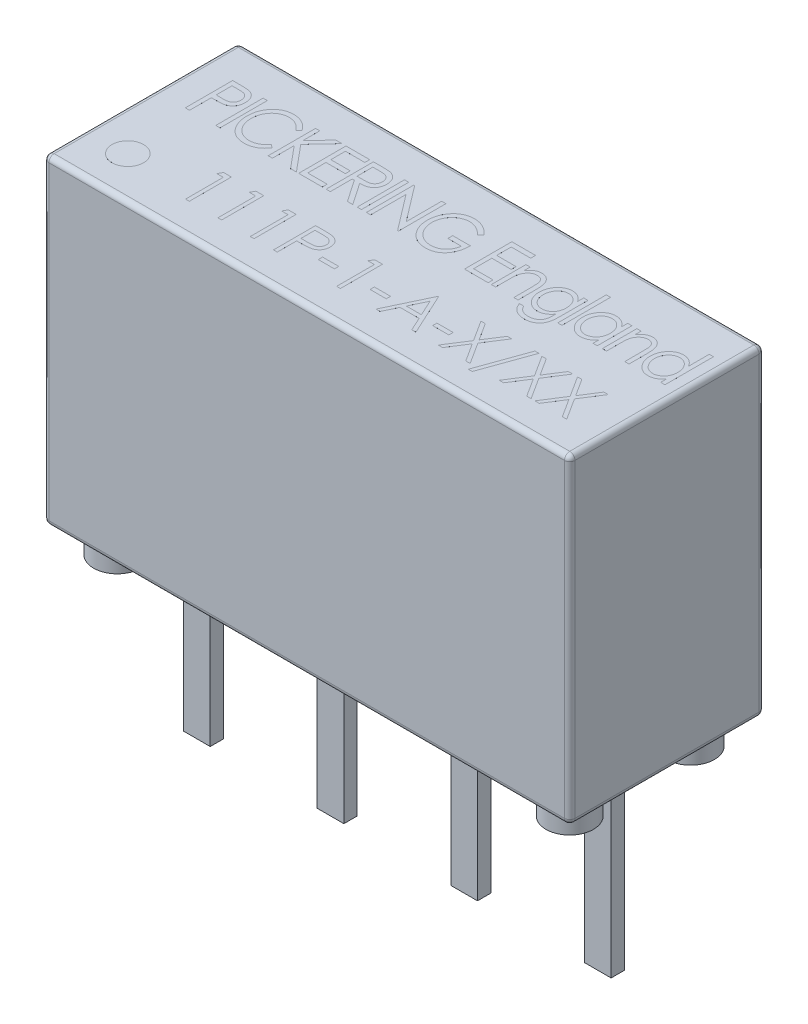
SolidWorks part; units mm, degrees
ref_plane "Front Plane" through (0, 0, 0) normal (0, 0, 1) x (1, 0, 0)
ref_plane "Top Plane" through (0, 0, 0) normal (0, 1, 0) x (1, 0, 0)
ref_plane "Right Plane" through (0, 0, 0) normal (1, 0, 0) x (0, 0, -1)
sketch "Sketch1" plane through (0, 0, 0) normal (0, 1, 0) x (1, 0, 0)
  line L1 (5, -1.85) -> (-5, -1.85)
  line L2 (5, -1.85) -> (5, 1.85)
  line L3 (5, 1.85) -> (-5, 1.85)
  line L4 (-5, -1.85) -> (-5, 1.85)
  line L5 (5, -1.85) -> (-5, 1.85) construction
  line L6 (5, 1.85) -> (-5, -1.85) construction
  point P0 (0, 0)
  dimension "D1" = 3.7
  dimension "D2" = 10
extrude "Main Body" add sketch "Sketch1" along normal blind 6.092
sketch "Sketch2"
  dimension "D1" = 0.9
  dimension "D3" = 0.7
  dimension "D4" = 0.9
  dimension "D6" = 0.9
  dimension "D8" = 0.9
  dimension "D2" = 0.7
  dimension "D5" = 0.7
  dimension "D7" = 0.7
extrude "Feet" add sketch "Sketch2" along normal blind 0.508
sketch "Sketch3" plane through (0, 0, 0) normal (0, -1, 0) x (1, 0, 0)
  line L0 (5, 1.85) -> (5, -1.85) construction
  line L1 (-4.064, -0.127) -> (-3.556, -0.127)
  line L2 (-4.064, -0.127) -> (-4.064, 0.127)
  line L3 (-4.064, 0.127) -> (-3.556, 0.127)
  line L4 (-3.556, -0.127) -> (-3.556, 0.127)
  line L5 (-4.064, -0.127) -> (-3.556, 0.127) construction
  line L6 (-4.064, 0.127) -> (-3.556, -0.127) construction
  line L7 (-1.524, -0.127) -> (-1.016, -0.127)
  line L8 (-1.524, -0.127) -> (-1.524, 0.127)
  line L9 (-1.524, 0.127) -> (-1.016, 0.127)
  line L10 (-1.016, -0.127) -> (-1.016, 0.127)
  line L11 (-1.524, -0.127) -> (-1.016, 0.127) construction
  line L12 (-1.524, 0.127) -> (-1.016, -0.127) construction
  line L13 (1.524, -0.127) -> (1.016, -0.127)
  line L14 (1.524, -0.127) -> (1.524, 0.127)
  line L15 (1.524, 0.127) -> (1.016, 0.127)
  line L16 (1.016, -0.127) -> (1.016, 0.127)
  line L17 (1.524, -0.127) -> (1.016, 0.127) construction
  line L18 (1.524, 0.127) -> (1.016, -0.127) construction
  line L19 (4.064, -0.127) -> (3.556, -0.127)
  line L20 (4.064, -0.127) -> (4.064, 0.127)
  line L21 (4.064, 0.127) -> (3.556, 0.127)
  line L22 (3.556, -0.127) -> (3.556, 0.127)
  line L23 (4.064, -0.127) -> (3.556, 0.127) construction
  line L24 (4.064, 0.127) -> (3.556, -0.127) construction
  point P0 (-3.81, 0)
  point P5 (-1.27, 0)
  point P10 (1.27, 0)
  point P15 (3.81, 0)
  dimension "D1" = 0.508
  dimension "D2" = 0.254
  dimension "D3" = 0.508
  dimension "D4" = 0.254
  dimension "D5" = 0.508
  dimension "D6" = 0.254
  dimension "D7" = 0.508
  dimension "D8" = 0.254
  dimension "D9" = 2.54
  dimension "D10" = 2.54
  dimension "D11" = 2.54
  dimension "D12" = 1.19
extrude "Pins" add sketch "Sketch3" along normal blind 3.808
fillet "Fillet1" radius 0.1 12 edges at (5, 6.092, 0) (5, 0, 0) (5, 3.046, -1.85) (0, 6.092, -1.85) (0, 0, -1.85) (-5, 3.046, -1.85) (-5, 6.092, 0) (-5, 0, 0) (-5, 3.046, 1.85) (0, 6.092, 1.85) (5, 3.046, 1.85) (0, 0, 1.85)
sketch "Sketch4"
  dimension "D5" = 0.6
  dimension "D1" = 1.5
  dimension "D2" = 9
  dimension "D3" = 0.4
  dimension "D4" = 1.5
  dimension "D6" = 0.7
  dimension "D7" = 0.7
extrude "Lettering" add sketch "Sketch4" along normal blind 0.0001
